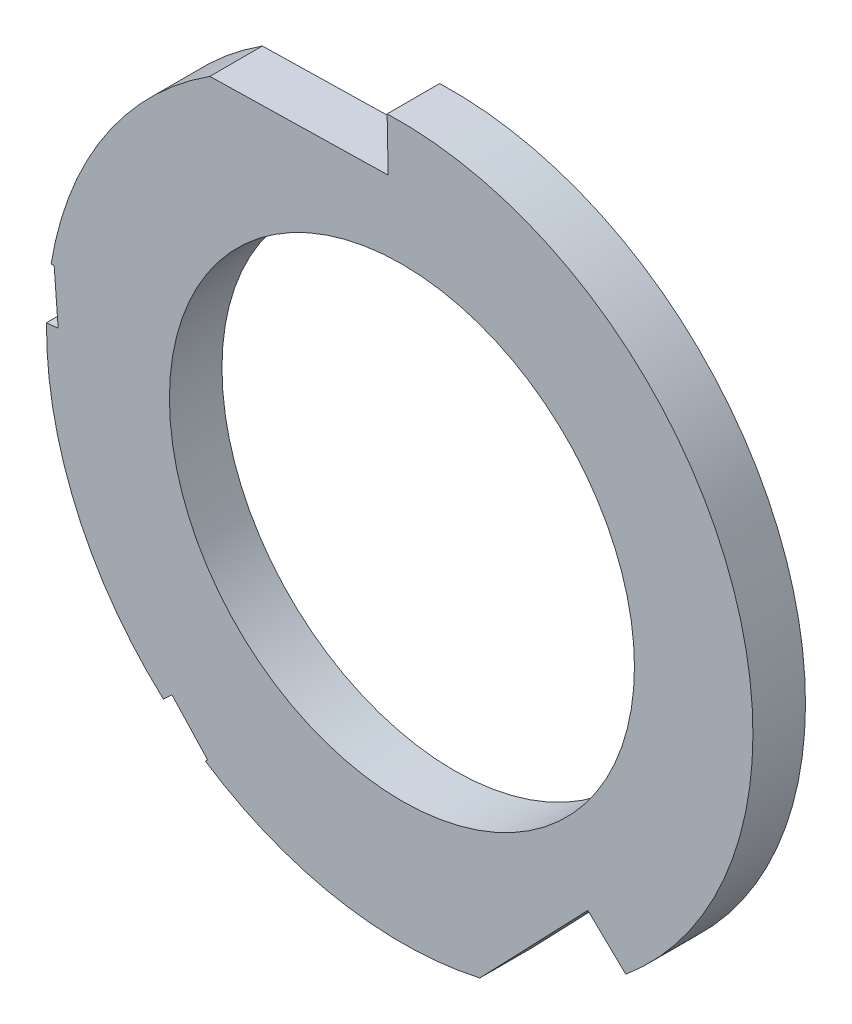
SolidWorks part; units mm, degrees
ref_plane "Front Plane" through (0, 0, 0) normal (0, 0, 1) x (1, 0, 0)
ref_plane "Top Plane" through (0, 0, 0) normal (0, 1, 0) x (1, 0, 0)
ref_plane "Right Plane" through (0, 0, 0) normal (1, 0, 0) x (0, 0, -1)
sketch "Sketch1" plane through (0, 0, 0) normal (0, 0, 1) x (1, 0, 0)
  line L0 (9.0389, 5.3974) -> (9.0699, 3.8737)
  line L1 (9.0699, 3.8737) -> (3.8966, 3.7685)
  line L3 (15.9611, -12.7526) -> (14.8614, -11.6975)
  line L4 (14.8614, -11.6975) -> (11.7282, -14.9633)
  line L6 (-0.7066, -3.2491) -> (-0.6186, -3.2423)
  line L8 (-0.6186, -3.2423) -> (-0.501, -4.7618)
  line L9 (-0.501, -4.7618) -> (-0.8398, -4.788)
  line L11 (3.7691, -13.4953) -> (3.834, -13.4353)
  line L13 (3.834, -13.4353) -> (2.7991, -12.3166)
  line L14 (2.7991, -12.3166) -> (2.5496, -12.5473)
  arc A0 (3.8966, 3.7685) -> (-0.7066, -3.2491) centre (9.4685, -4.905) ccw
  circle A1 centre (9.4685, -4.905) radius 6.7437
  arc A2 (-0.8398, -4.788) -> (2.5496, -12.5473) centre (9.4685, -4.905) ccw
  arc A3 (3.7691, -13.4953) -> (11.7282, -14.9633) centre (9.4685, -4.905) ccw
  arc A4 (9.0389, 5.3974) -> (15.9611, -12.7526) centre (9.3775, -4.8685) cw
extrude "Boss-Extrude1" add sketch "Sketch1" along normal blind 1.524
